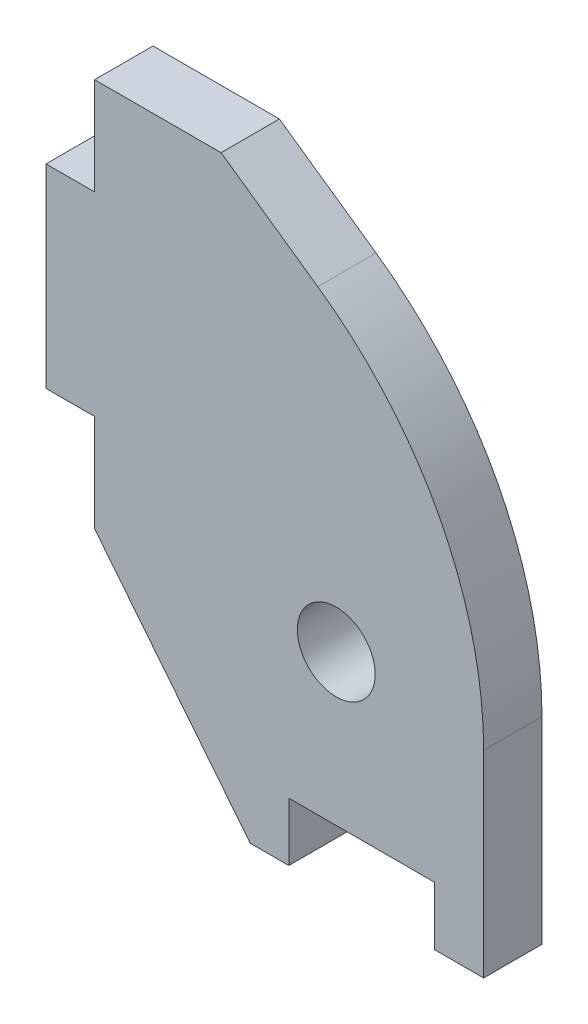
SolidWorks part; units mm, degrees
ref_plane "Front Plane" through (0, 0, 0) normal (0, 0, 1) x (1, 0, 0)
ref_plane "Top Plane" through (0, 0, 0) normal (0, 1, 0) x (1, 0, 0)
ref_plane "Right Plane" through (0, 0, 0) normal (1, 0, 0) x (0, 0, -1)
sketch "Sketch1" plane through (0, 0, 0) normal (0, 0, 1) x (1, 0, 0)
  line L0 (0, 0) -> (0, 46.4129) construction
  line L1 (0, 0) -> (58.8153, 0) construction
  line L2 (0, 30) -> (6.5, 30)
  line L3 (6.5, 30) -> (11.4715, 26.5189)
  line L4 (20, 10.1359) -> (20, 0)
  line L5 (0, 10) -> (8, 0)
  line L6 (8, 0) -> (20, 0)
  line L7 (0, 30) -> (0, 10)
  arc A0 (11.4715, 26.5189) -> (20, 10.1359) centre (0, 10.1359) cw
  dimension "D3" = 20
  dimension "D1" = 6.5
  dimension "D2" = 30
  dimension "D4" = 20
  dimension "D5" = 12
  dimension "D6" = 10
  dimension "D7" = 55
extrude "Boss-Extrude1" add sketch "Sketch1" along normal blind 3
hole_wizard "Ø4.0 (4) Diameter Hole1" positions "Sketch2" profile "Sketch3" hole size "Ø4.0" standard "ANSI Metric"
sketch "Sketch2" plane through (0, 0, 3) normal (0, 0, 1) x (1, 0, 0)
  point P0 (12.4233, 10.7288)
sketch "Sketch3" plane through (12.4233, 10.7288, 3) normal (1, 0, 0) x (0, -1, 0)
  line L0 (0, 0) -> (0, 3)
  line L1 (0, 3) -> (2, 3)
  line L2 (2, 3) -> (2, 0)
  line L5 (2, 0) -> (0, 0)
  line L11 (0, -6.35) -> (0, 107.95) construction
  dimension "Thru Hole Dia." = 4
  dimension "Thru Hole Depth" = 3
sketch "Sketch4" plane through (0, 0, 3) normal (0, 0, 1) x (1, 0, 0)
  line L0 (8, 0) -> (20, 0) construction
  line L1 (9.982, 0) -> (17.482, 0)
  line L2 (9.982, 0) -> (9.982, 3)
  line L3 (9.982, 3) -> (17.482, 3)
  line L4 (17.482, 0) -> (17.482, 3)
  dimension "D1" = 7.5
  dimension "D2" = 3
extrude "Cut-Extrude1" cut sketch "Sketch4" against normal through all
sketch "Sketch5" plane through (0, 0, 0) normal (-1, 0, 0) x (0, 0, 1)
  line L0 (0, 30) -> (0, 10) construction
  line L1 (0, 15) -> (3, 15)
  line L2 (0, 15) -> (0, 25)
  line L3 (0, 25) -> (3, 25)
  line L4 (3, 15) -> (3, 25)
  line L5 (3, 30) -> (3, 10) construction
  line L6 (0, 20) -> (3, 20) construction
  line L7 (3, 20) -> (0, 20) construction
  dimension "D1" = 10
extrude "Boss-Extrude2" add sketch "Sketch5" along normal blind 2.5
